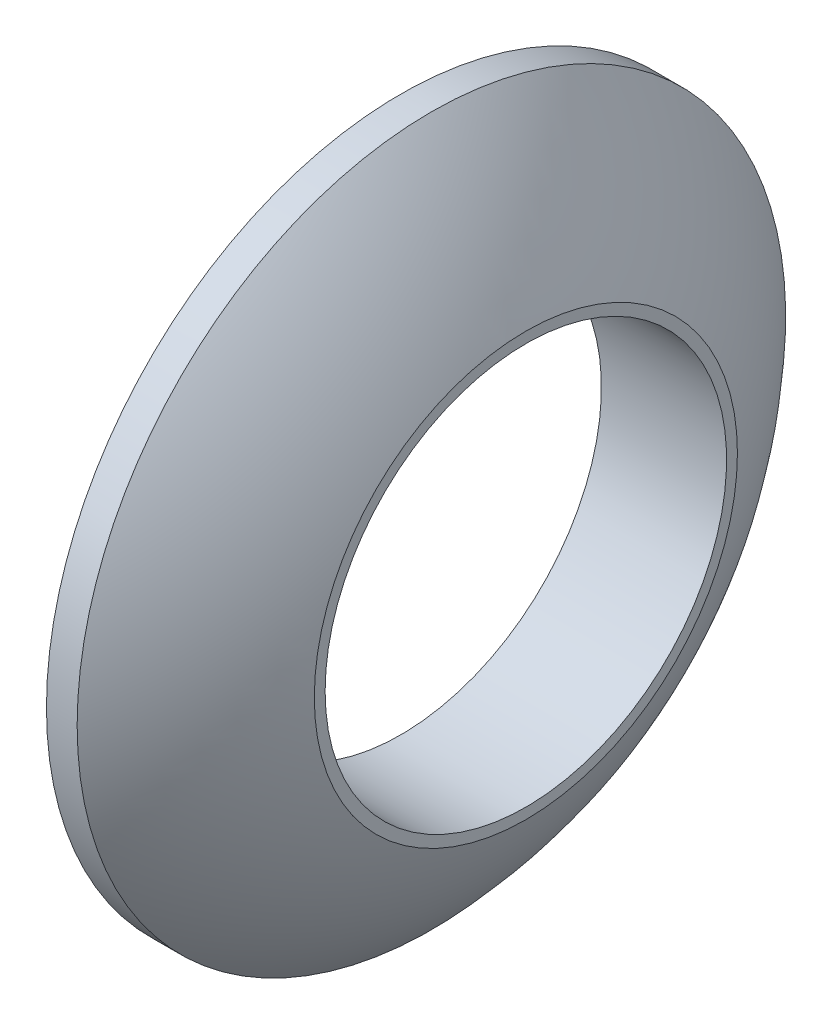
SolidWorks part; units mm, degrees
ref_plane "Plan de face" through (0, 0, 0) normal (0, 0, 1) x (1, 0, 0)
ref_plane "Plan de dessus" through (0, 0, 0) normal (0, 1, 0) x (1, 0, 0)
ref_plane "Plan de droite" through (0, 0, 0) normal (1, 0, 0) x (0, 0, -1)
sketch "Esquisse1" plane through (0, 0, 0) normal (0, 0, 1) x (1, 0, 0)
  line L0 (-22.9507, 0) -> (43.3423, 0) construction
  line L1 (0, 8.5) -> (0, 15)
  line L2 (0, 15) -> (1.3, 15)
  line L4 (5.3, 8.9584) -> (5.3, 8.5)
  line L5 (5.3, 8.5) -> (0, 8.5)
  arc A0 (5.3, 8.9584) -> (1.3, 15) centre (-14.7935, 0) ccw
  dimension "D4" = 22
  dimension "D1" = 17
  dimension "D2" = 30
  dimension "D3" = 5.3
  dimension "D5" = 1.3
revolve "Révolution1" add sketch "Esquisse1" angle 360 about L0
